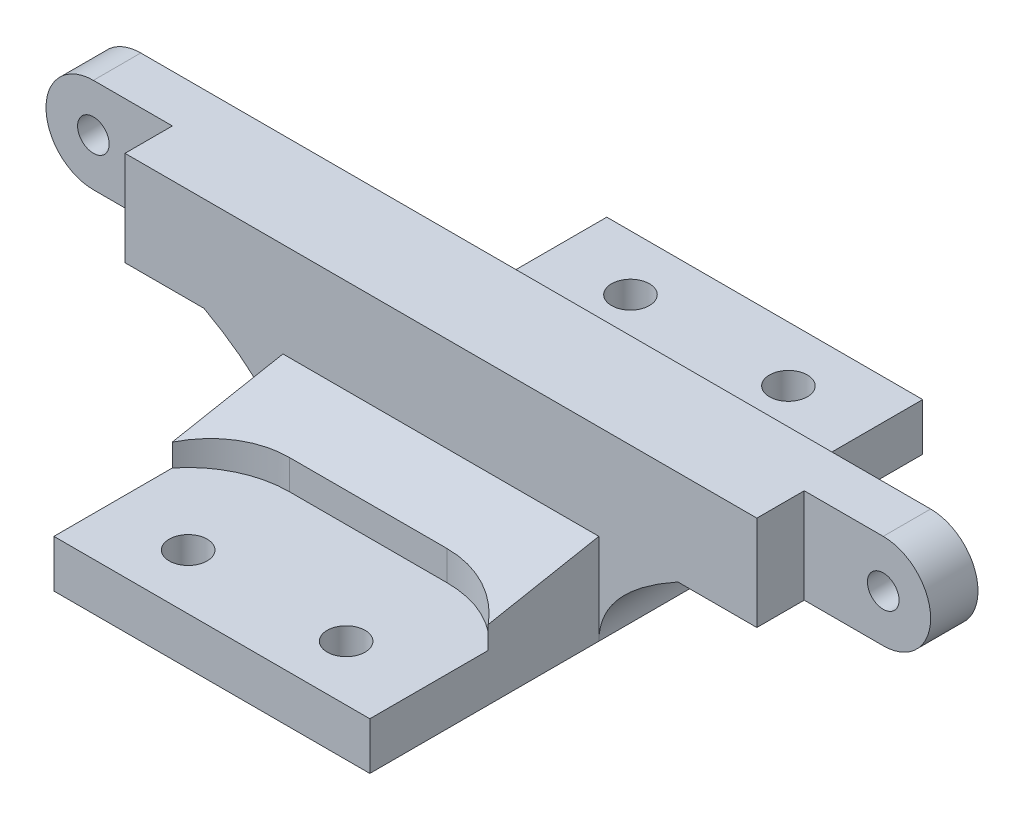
SolidWorks part; units mm, degrees
ref_plane "Front Plane" through (0, 0, 0) normal (0, 0, 1) x (1, 0, 0)
ref_plane "Top Plane" through (0, 0, 0) normal (0, 1, 0) x (1, 0, 0)
ref_plane "Right Plane" through (0, 0, 0) normal (1, 0, 0) x (0, 0, -1)
sketch "Sketch1" plane through (0, 0, 0) normal (0, 0, 1) x (1, 0, 0)
  line L0 (-31.75, 11.1125) -> (31.75, 11.1125) construction
  line L1 (-31.75, 11.1125) -> (31.75, 11.1125) construction
  line L2 (-31.75, 11.1125) -> (-31.75, -11.1125) construction
  line L3 (-31.75, -11.1125) -> (31.75, -11.1125) construction
  line L4 (31.75, 11.1125) -> (31.75, -11.1125) construction
  line L5 (-31.75, 11.1125) -> (31.75, -11.1125) construction
  line L6 (-31.75, -11.1125) -> (31.75, 11.1125) construction
  line L7 (-31.75, 14.9225) -> (31.75, 14.9225)
  line L8 (-31.75, 7.3025) -> (31.75, 7.3025)
  line L10 (-12.7, 10.4336) -> (12.7, 10.4336)
  line L11 (-12.7, 10.4336) -> (-12.7, 0)
  line L12 (-12.7, 0) -> (12.7, 0)
  line L13 (12.7, 10.4336) -> (12.7, 0)
  line L14 (-12.7, 10.4336) -> (12.7, 0) construction
  line L15 (-12.7, 0) -> (12.7, 10.4336) construction
  arc A0 (-31.75, 14.9225) -> (-31.75, 7.3025) centre (-31.75, 11.1125) ccw
  arc A1 (31.75, 7.3025) -> (31.75, 14.9225) centre (31.75, 11.1125) ccw
  point P0 (0, 0)
  point P6 (0, 11.1125)
  point P11 (0, 5.2168)
  dimension "D3" = 3.81
  dimension "D1" = 11.1125
  dimension "D2" = 63.5
  dimension "D4" = 25.4
extrude "Boss-Extrude1" add sketch "Sketch1" along normal mid plane 7.62 contours L13 L8 L11 L12 | L8 A1 L7 A0 L11 L10 L13 | L13 L10 L11 L8
sketch "Sketch2" plane through (0, 0, 0) normal (1, 0, 0) x (0, 0, -1)
  line L0 (-3.81, 0) -> (-22.225, 0)
  line L1 (-22.225, 0) -> (-22.225, 3.81)
  line L2 (-22.225, 3.81) -> (-3.81, 7.3025)
  line L3 (-3.81, 7.3025) -> (-3.81, 0)
  line L4 (0, 0) -> (0, 16.6659) construction
  line L5 (-3.81, 0) -> (3.81, 0) construction
  line L6 (22.225, 3.81) -> (3.81, 7.3025)
  line L7 (22.225, 0) -> (22.225, 3.81)
  line L8 (3.81, 0) -> (22.225, 0)
  line L9 (3.81, 7.3025) -> (3.81, 0)
  dimension "D1" = 22.225
  dimension "D2" = 3.81
extrude "Boss-Extrude2" add sketch "Sketch2" along normal mid plane 25.4
sketch "Sketch3" plane through (0, 0, 0) normal (0, -1, 0) x (-1, 0, 0)
  line L0 (0, 9.525) -> (0, -9.525) construction
  line L1 (2.54, 9.525) -> (2.54, -9.525)
  line L2 (-2.54, 9.525) -> (-2.54, -9.525)
  arc A0 (2.54, 9.525) -> (-2.54, 9.525) centre (0, 9.525) ccw
  arc A1 (-2.54, -9.525) -> (2.54, -9.525) centre (0, -9.525) ccw
  point P2 (0, 0)
  dimension "D2" = 2.54
  dimension "D1" = 19.05
extrude "Cut-Extrude1" cut sketch "Sketch3" against normal blind 2.54
sketch "Sketch4" plane through (0, 14.9225, 0) normal (0, 1, 0) x (1, 0, 0)
  line L0 (-6.35, -17.78) -> (6.35, -17.78) construction
  line L1 (-6.35, -9.652) -> (6.35, -9.652)
  line L2 (-6.35, -25.908) -> (6.35, -25.908)
  line L3 (-14.2057, 0) -> (16.1828, 0) construction
  line L4 (0, 0) -> (0, -17.78) construction
  line L5 (-6.35, 17.78) -> (6.35, 17.78) construction
  line L6 (-6.35, 9.652) -> (6.35, 9.652)
  line L7 (-6.35, 25.908) -> (6.35, 25.908)
  arc A0 (-6.35, -9.652) -> (-6.35, -25.908) centre (-6.35, -17.78) ccw
  arc A1 (6.35, -25.908) -> (6.35, -9.652) centre (6.35, -17.78) ccw
  arc A2 (-6.35, 9.652) -> (-6.35, 25.908) centre (-6.35, 17.78) cw
  arc A3 (6.35, 25.908) -> (6.35, 9.652) centre (6.35, 17.78) cw
  point P2 (0, -17.78)
  point P14 (0, 17.78)
  dimension "D2" = 8.128
  dimension "D1" = 17.78
  dimension "D3" = 12.7
extrude "Cut-Extrude2" cut sketch "Sketch4" against normal up to vertex (11.1125 mm away)
sketch "Sketch5" plane through (0, 3.81, 0) normal (0, 1, 0) x (1, 0, 0)
  line L0 (-13.8396, 0) -> (13.8396, 0) construction
  circle A0 centre (-6.35, -17.78) radius 1.524
  circle A1 centre (6.35, -17.78) radius 1.524
  circle A2 centre (6.35, 17.78) radius 1.524
  circle A3 centre (-6.35, 17.78) radius 1.524
  dimension "D1" = 3.048
extrude "Cut-Extrude3" cut sketch "Sketch5" against normal through all
sketch "Sketch6" plane through (0, 14.9225, 0) normal (0, 1, 0) x (1, 0, 0)
  line L0 (-12.7, -3.81) -> (-12.7, -12.7064) construction
  line L1 (-39.255, 0) -> (-25.4, 0)
  line L2 (-39.255, 0) -> (-39.255, -8.3936)
  line L3 (-39.255, -8.3936) -> (-25.4, -8.3936)
  line L4 (-25.4, 0) -> (-25.4, -8.3936)
  line L5 (44.8263, 0) -> (25.4, 0)
  line L6 (44.8263, 0) -> (44.8263, -8.9068)
  line L7 (44.8263, -8.9068) -> (25.4, -8.9068)
  line L8 (25.4, 0) -> (25.4, -8.9068)
  line L9 (12.7, -3.81) -> (12.7, -12.7064) construction
  line L10 (-31.75, -3.81) -> (31.75, -3.81) construction
  dimension "D1" = 12.7
  dimension "D2" = 12.7
  dimension "D3" = 3.81
  dimension "D4" = 3.81
extrude "Cut-Extrude4" cut sketch "Sketch6" against normal through all
sketch "Sketch7" plane through (0, 0, -3.81) normal (0, 0, -1) x (-1, 0, 0)
  circle A0 centre (-31.75, 11.1125) radius 1.27
  circle A1 centre (31.75, 11.1125) radius 1.27
  dimension "D1" = 2.54
  dimension "D2" = 2.54
extrude "Cut-Extrude5" cut sketch "Sketch7" against normal through all
sketch "Sketch8" plane through (0, 0, 0) normal (0, 0, 1) x (1, 0, 0)
  line L0 (-25.4, 7.3025) -> (-12.7, 7.3025) construction
  line L4 (-12.7, 0) -> (-12.7, 3.81) construction
  line L5 (-12.7, 3.81) -> (-19.05, 7.3025) construction
  line L6 (-19.05, 7.3025) -> (-12.7, 7.3025)
  line L8 (-12.7, 7.3025) -> (-12.7, 0)
  line L9 (0, 0) -> (0, 14.9225) construction
  line L10 (-25.4, 14.9225) -> (25.4, 14.9225) construction
  line L11 (19.05, 7.3025) -> (12.7, 7.3025)
  line L12 (12.7, 0) -> (12.7, 3.81) construction
  line L13 (12.7, 3.81) -> (19.05, 7.3025) construction
  line L14 (12.7, 7.3025) -> (12.7, 0)
  spline S0 degree 2 poles (-12.7, 0) (-12.7, 3.81) (-19.05, 7.3025) knots 0 0 0 1 1 1
  spline S1 degree 2 poles (12.7, 0) (12.7, 3.81) (19.05, 7.3025) knots 0 0 0 1 1 1
extrude "Boss-Extrude3" add sketch "Sketch8" along normal mid plane 7.62
